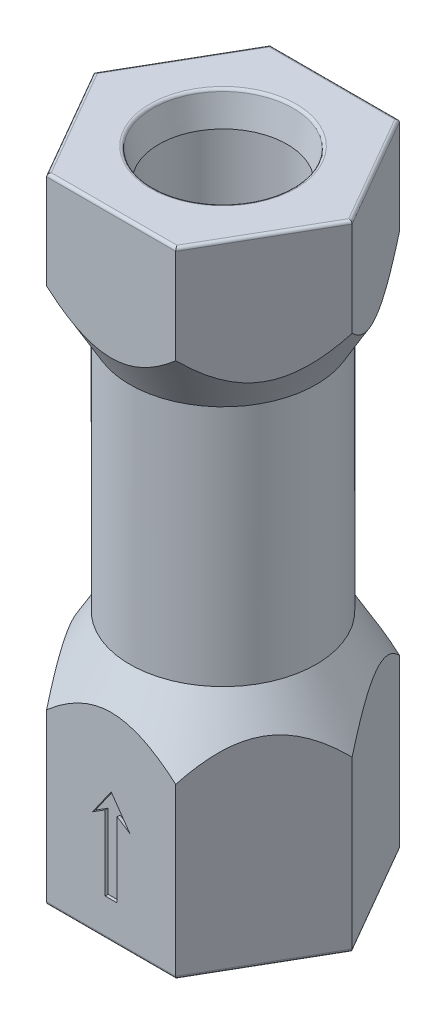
SolidWorks part; units mm, degrees
ref_plane "Front Plane" through (0, 0, 0) normal (0, 0, 1) x (1, 0, 0)
ref_plane "Top Plane" through (0, 0, 0) normal (0, 1, 0) x (1, 0, 0)
ref_plane "Right Plane" through (0, 0, 0) normal (1, 0, 0) x (0, 0, -1)
sketch "Sketch1" plane through (0, 0, 0) normal (0, 1, 0) x (1, 0, 0)
  line L1 (10.9985, 0) -> (5.4993, 9.525)
  line L2 (5.4993, 9.525) -> (-5.4993, 9.525)
  line L3 (-5.4993, 9.525) -> (-10.9985, 0)
  line L4 (-10.9985, 0) -> (-5.4993, -9.525)
  line L5 (-5.4993, -9.525) -> (5.4993, -9.525)
  line L6 (5.4993, -9.525) -> (10.9985, 0)
  circle A0 centre (0, 0) radius 9.525 construction
  dimension "D1" = 19.05
extrude "Boss-Extrude1" add sketch "Sketch1" along normal blind 54.0258
ref_plane "MidPlane" through (0, 27.0129, 0) normal (0, -1, 0) x (-1, 0, 0)
hole_wizard "Ø5.0 (5) Diameter Hole1" positions "Sketch2" profile "Sketch3" hole size "Ø5.0" standard "ANSI Metric"
sketch "Sketch2" plane through (0, 27.0129, 0) normal (0, -1, 0) x (-1, 0, 0)
  point P0 (0, 0)
sketch "Sketch3" plane through (0, 27.0129, 0) normal (1, 0, 0) x (0, 0, 1)
  line L0 (0, 0) -> (0, 27.0129)
  line L1 (0, 27.0129) -> (2.5, 27.0129)
  line L2 (2.5, 27.0129) -> (2.5, 0)
  line L5 (2.5, 0) -> (0, 0)
  line L11 (0, -6.35) -> (0, 107.95) construction
  dimension "Thru Hole Dia." = 5
  dimension "Thru Hole Depth" = 27.0129
hole_wizard "Ø5.0 (5) Diameter Hole2" positions "Sketch8" profile "Sketch9" hole size "Ø5.0" standard "ANSI Metric"
sketch "Sketch8" plane through (0, 27.0129, 0) normal (0, -1, 0) x (-1, 0, 0)
  point P0 (0, 0)
sketch "Sketch9" plane through (0, 27.0129, 0) normal (1, 0, 0) x (0, 0, -1)
  line L0 (0, 0) -> (0, 27.0129)
  line L1 (0, 27.0129) -> (2.5, 27.0129)
  line L2 (2.5, 27.0129) -> (2.5, 0)
  line L5 (2.5, 0) -> (0, 0)
  line L11 (0, -6.35) -> (0, 107.95) construction
  dimension "Thru Hole Dia." = 5
  dimension "Thru Hole Depth" = 27.0129
ref_plane "Plane2" through (0, 31.1129, 0) normal (0, 1, 0) x (1, 0, 0)
hole_wizard "Ø5.6 (5.6) Diameter Hole2" positions "Sketch12" profile "Sketch13" hole size "Ø5.6" standard "ANSI Metric"
sketch "Sketch12" plane through (0, 31.1129, 0) normal (0, 1, 0) x (1, 0, 0)
  point P0 (0, 0)
sketch "Sketch13" plane through (0, 31.1129, 0) normal (1, 0, 0) x (0, 0, -1)
  line L0 (0, 0) -> (0, 22.9129)
  line L1 (0, 22.9129) -> (2.8, 22.9129)
  line L2 (2.8, 22.9129) -> (2.8, 0)
  line L5 (2.8, 0) -> (0, 0)
  line L11 (0, -6.35) -> (0, 107.95) construction
  dimension "Thru Hole Dia." = 5.6
  dimension "Thru Hole Depth" = 22.9129
chamfer "Chamfer1" distance 0.1803 angle 59 1 edges at (0, 31.1129, -2.5)
sketch "Sketch21" plane through (-4.7048, 54.0258, -1.11) normal (0, -1, 0) x (1, 0, 0)
  line L0 (1.7975, 2.386) -> (7.612, -0.1661) construction
  line L1 (3.175, 0) -> (0.6228, -5.8145) construction
  circle A0 centre (4.7048, 1.11) radius 2.8 construction
  point P5 (4.7048, 1.11)
  dimension "D3" = 6.35
ref_plane "Plane1" through (0, 54.0258, 0) normal (0.9157, 0, -0.4019) x (-0.4019, 0, -0.9157)
sketch "Port Sketch" plane through (0.0945, 54.0258, 0.2154) normal (-0.9157, 0, 0.4019) x (-0.4019, 0, -0.9157)
  line L0 (0.2352, 0) -> (0.2352, 45.0293) construction
  line L1 (0.2352, 17.006) -> (5.1958, 14.0254)
  line L2 (5.1958, 14.0254) -> (5.1958, 11.5254)
  line L3 (5.1958, 11.5254) -> (5.7915, 11.5254)
  line L4 (5.7915, 11.5254) -> (5.7915, 2.5358)
  line L5 (5.7915, 2.5358) -> (5.7019, 2.6254)
  line L6 (5.7019, 2.6254) -> (6.2118, 0.2266)
  line L7 (6.4602, 0.0254) -> (12.9352, 0.0254)
  line L8 (12.9352, 0.0254) -> (12.9352, 0)
  line L10 (12.9352, 0) -> (0.2352, 0)
  line L11 (0.2352, 0) -> (0.2352, 17.006)
  line L12 (-5.2315, 2.6254) -> (-5.7413, 0.2266) construction
  line L13 (-5.321, 2.5358) -> (-5.2315, 2.6254) construction
  line L14 (0.2352, 17.006) -> (-4.7254, 14.0254) construction
  arc A0 (6.2118, 0.2266) -> (6.4602, 0.0254) centre (6.4602, 0.2794) ccw
  dimension "D1" = 0.254
  dimension "Countersink angle" = 118
  dimension "D3" = 45
  dimension "TapDrillDia" = 9.9212
  dimension "D5" = 12.45
  dimension "ThdMjr" = 11.1125
  dimension "SpotDia" = 25.4
  dimension "L3" = 0.0254
  dimension "L1" = 2.6
  dimension "ThdDp" = 11.5
  dimension "TapDrillDp" = 14
  dimension "K" = 12
revolve "SAE Port" cut sketch "Port Sketch" angle 360 about L0
other "sae j1926-1 (circular face)<1>"
sketch "Sketch22" plane through (-7.2096, 0, 0.2371) normal (0, 1, 0) x (-1, 0, 0)
  line L0 (-4.3398, 1.1211) -> (-10.0795, -1.5953) construction
  line L1 (3.175, 0) -> (0.4586, 5.7396) construction
  circle A0 centre (-7.2096, -0.2371) radius 2.5 construction
  point P5 (-7.2096, -0.2371)
  dimension "D3" = 6.35
ref_plane "Plane11" through (0, 0, 0) normal (0.9039, 0, -0.4278) x (-0.4278, 0, -0.9039)
sketch "Port Sketch1" plane through (-1.1025, 0, -2.3296) normal (-0.9039, 0, 0.4278) x (0.4278, 0, 0.9039)
  line L0 (2.5774, 0) -> (2.5774, 45.0293) construction
  line L1 (2.5774, 17.006) -> (7.538, 14.0254)
  line L2 (7.538, 14.0254) -> (7.538, 11.5254)
  line L3 (7.538, 11.5254) -> (8.1336, 11.5254)
  line L4 (8.1336, 11.5254) -> (8.1336, 2.5358)
  line L5 (8.1336, 2.5358) -> (8.044, 2.6254)
  line L6 (8.044, 2.6254) -> (8.5539, 0.2266)
  line L7 (8.8024, 0.0254) -> (15.2774, 0.0254)
  line L8 (15.2774, 0.0254) -> (15.2774, 0)
  line L10 (15.2774, 0) -> (2.5774, 0)
  line L11 (2.5774, 0) -> (2.5774, 17.006)
  line L12 (-2.8893, 2.6254) -> (-3.3992, 0.2266) construction
  line L13 (-2.9789, 2.5358) -> (-2.8893, 2.6254) construction
  line L14 (2.5774, 17.006) -> (-2.3833, 14.0254) construction
  arc A0 (8.5539, 0.2266) -> (8.8024, 0.0254) centre (8.8024, 0.2794) ccw
  dimension "D1" = 0.254
  dimension "Countersink angle" = 118
  dimension "D3" = 45
  dimension "TapDrillDia" = 9.9212
  dimension "D5" = 12.45
  dimension "ThdMjr" = 11.1125
  dimension "SpotDia" = 25.4
  dimension "L3" = 0.0254
  dimension "L1" = 2.6
  dimension "ThdDp" = 11.5
  dimension "TapDrillDp" = 14
  dimension "K" = 12
revolve "SAE Port1" cut sketch "Port Sketch1" angle 360 about L0
other "sae j1926-1 (circular face)<2>"
sketch "Sketch24" plane through (0, 0, 0) normal (0, 0, 1) x (1, 0, 0)
  line L0 (0, 0) -> (0, 54.0004) construction
  line L1 (5.4993, 54.0004) -> (-5.4993, 54.0004) construction
  line L2 (7.9375, 40.3796) -> (7.9375, 19.7421)
  line L3 (7.9375, 19.7421) -> (13.0175, 10.9433)
  line L4 (13.0175, 10.9433) -> (13.0175, 49.1785)
  line L5 (13.0175, 49.1785) -> (7.9375, 40.3796)
  line L6 (-55, 27.0129) -> (55, 27.0129) construction
  point P7 (7.9375, 30.0609)
  dimension "D1" = 7.9375
  dimension "D2" = 150
  dimension "D3" = 150
  dimension "D4" = 5.08
  dimension "D5" = 3.048
  dimension "D6" = 20.6375
revolve "Cut-Revolve3" cut sketch "Sketch24" angle 360 about L0
sketch "Sketch25" plane through (0, 0, 9.525) normal (0, 0, 1) x (1, 0, 0)
  line L0 (-0.508, 3.2004) -> (-0.508, 9.5504)
  line L1 (-0.508, 9.5504) -> (-1.5875, 8.8707)
  line L2 (-1.5875, 8.8707) -> (0, 11.1379)
  line L3 (-0.508, 3.2004) -> (0.508, 3.2004)
  line L4 (0, 0.0254) -> (0, 14.1809) construction
  line L5 (0.508, 3.2004) -> (0.508, 9.5504)
  line L6 (0.508, 9.5504) -> (1.5875, 8.8707)
  line L7 (1.5875, 8.8707) -> (0, 11.1379)
  line L8 (-5.4993, 0.0254) -> (5.4993, 0.0254) construction
  point P9 (0, 3.2004)
  point P14 (0, 0.0254)
  dimension "D1" = 0.508
  dimension "D2" = 3.175
  dimension "D3" = 35
  dimension "D4" = 1.5875
  dimension "D5" = 11.1125
  dimension "D6" = 6.35
  dimension "D7" = 3.175
extrude "Cut-Extrude2" cut sketch "Sketch25" against normal blind 0.254
sketch "Sketch26" plane through (0, 0, -9.525) normal (0, 0, -1) x (-1, 0, 0)
  line L0 (-0.508, 3.2004) -> (-0.508, 9.5504)
  line L1 (-0.508, 9.5504) -> (-1.5875, 8.8707)
  line L2 (-1.5875, 8.8707) -> (0, 11.1379)
  line L3 (-0.508, 3.2004) -> (0.508, 3.2004)
  line L4 (0, 0.0254) -> (0, 11.3612) construction
  line L5 (0.508, 3.2004) -> (0.508, 9.5504)
  line L6 (0.508, 9.5504) -> (1.5875, 8.8707)
  line L7 (1.5875, 8.8707) -> (0, 11.1379)
  line L9 (-5.4993, 0.0254) -> (5.4993, 0.0254) construction
  point P9 (0, 3.2004)
  point P12 (0, 0.0254)
  dimension "D1" = 0.508
  dimension "D2" = 3.175
  dimension "D3" = 35
  dimension "D4" = 1.5875
  dimension "D5" = 11.1125
  dimension "D6" = 6.35
  dimension "D7" = 3.175
extrude "Cut-Extrude3" cut sketch "Sketch26" against normal blind 0.254
fillet "Fillet1" radius 0.254 12 edges at (8.2489, 54.0004, 4.7625) (8.2489, 54.0004, -4.7625) (0, 54.0004, -9.525) (-8.2489, 54.0004, -4.7625) (-8.2489, 54.0004, 4.7625) (0, 54.0004, 9.525) (-8.2489, 0.0254, 4.7625) (0, 0.0254, 9.525) (8.2489, 0.0254, 4.7625) (8.2489, 0.0254, -4.7625) (0, 0.0254, -9.525) (-8.2489, 0.0254, -4.7625)
